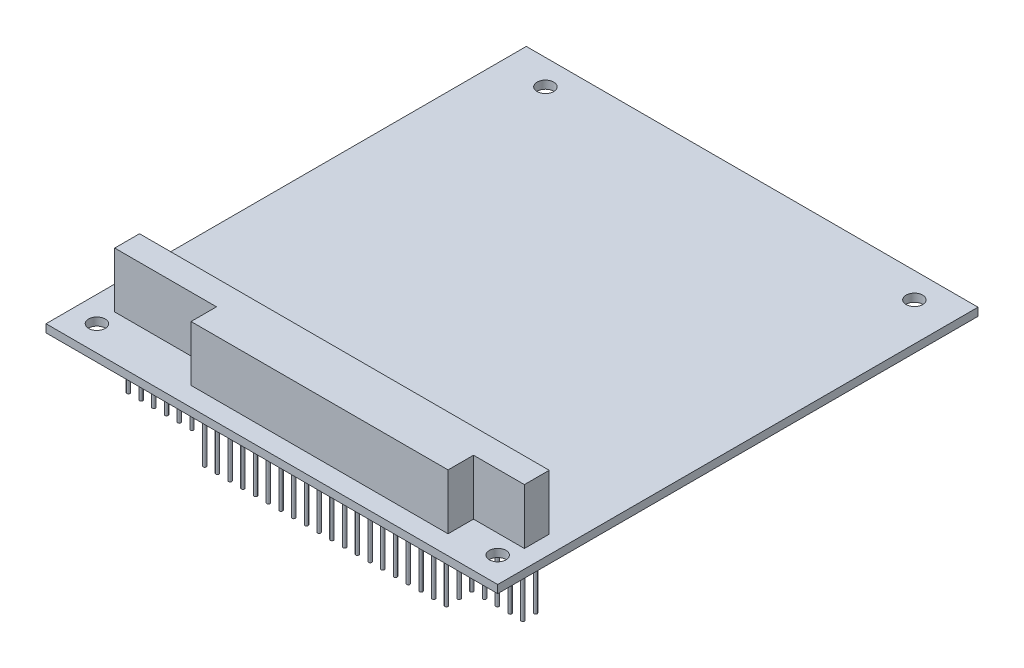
SolidWorks part; units mm, degrees
ref_plane "Front" through (0, 0, 0) normal (0, 0, 1) x (1, 0, 0)
ref_plane "Top" through (0, 0, 0) normal (0, 1, 0) x (1, 0, 0)
ref_plane "Right" through (0, 0, 0) normal (1, 0, 0) x (0, 0, -1)
sketch "Sketch1" plane through (0, 0, 0) normal (0, 1, 0) x (1, 0, 0)
  line L0 (45.085, -47.9425) -> (-45.085, 47.9425) construction
  line L1 (-45.085, 47.9425) -> (45.085, 47.9425)
  line L2 (-45.085, 47.9425) -> (-45.085, -47.9425)
  line L3 (-45.085, -47.9425) -> (45.085, -47.9425)
  line L4 (45.085, 47.9425) -> (45.085, -47.9425)
  circle A0 centre (-40.005, -42.8625) radius 1.651
  circle A1 centre (40.005, -42.8625) radius 1.651
  circle A2 centre (-36.195, 42.8625) radius 1.651
  circle A3 centre (37.465, 42.8625) radius 1.651
  dimension "D3" = 80.01
  dimension "D5" = 73.66
  dimension "D7" = 85.725
  dimension "D9" = 3.302
  dimension "D16" = 7.62
  dimension "D6" = 8.89
  dimension "D4" = 5.08
  dimension "D1" = 90.17
  dimension "D2" = 95.885
  dimension "D8" = 5.08
  dimension "D11" = 85.09
  dimension "D13" = 90.805
  dimension "D15" = 82.55
extrude "Extrude1" add sketch "Sketch1" along normal blind 1.5875
sketch "Sketch3" plane through (0, 1.5875, 0) normal (0, 1, 0) x (-1, 0, 0)
  line L0 (19.939, 44.1325) -> (19.939, 39.0525)
  line L1 (19.939, 39.0525) -> (40.259, 39.0525)
  line L2 (40.259, 39.0525) -> (40.259, 34.0995)
  line L3 (40.259, 34.0995) -> (-41.529, 34.0995)
  line L4 (-41.529, 34.0995) -> (-41.529, 39.0525)
  line L5 (-41.529, 39.0525) -> (-31.369, 39.0525)
  line L6 (-31.369, 39.0525) -> (-31.369, 44.1325)
  line L7 (-31.369, 44.1325) -> (19.939, 44.1325)
  line L8 (45.085, 47.9425) -> (-45.085, 47.9425) construction
  line L9 (45.085, -47.9425) -> (45.085, 47.9425) construction
  dimension "D1" = 81.788
  dimension "D2" = 4.953
  dimension "D3" = 5.08
  dimension "D4" = 20.32
  dimension "D5" = 71.628
  dimension "D6" = 3.81
  dimension "D7" = 4.826
extrude "Extrude2" add sketch "Sketch3" along normal blind 11.049
sketch "Sketch4" plane through (0, 0, 0) normal (0, -1, 0) x (1, 0, 0)
  line L0 (-40.259, 34.0995) -> (41.529, 34.0995) construction
  line L1 (41.529, 34.0995) -> (41.529, 39.0525) construction
  circle A0 centre (40.005, 35.306) radius 0.3175
  dimension "D1" = 1.2065
  dimension "D2" = 0.635
  dimension "D3" = 1.524
extrude "Extrude3" add sketch "Sketch4" along normal blind 12.192
pattern_linear "LPattern1" count 32 spacing 2.54 along (-1, 0, 0) count 4 spacing 2.54 along (0, 0, 1) of "Extrude3"
sketch "Connector Area" plane through (0, 0, 0) normal (0, 1, 0) x (1, 0, 0)
  line L0 (-45.085, 47.9425) -> (-45.085, -47.9425) construction
  line L1 (-45.085, -39.6875) -> (-57.785, -39.6875)
  line L2 (-45.085, -39.6875) -> (-45.085, 39.6875)
  line L3 (-45.085, 39.6875) -> (-57.785, 39.6875)
  line L4 (-57.785, -39.6875) -> (-57.785, 39.6875)
  line L5 (-36.83, -47.9425) -> (-20.955, -47.9425)
  line L6 (-36.83, -47.9425) -> (-36.83, -60.6425)
  line L7 (-36.83, -60.6425) -> (-20.955, -60.6425)
  line L8 (-20.955, -47.9425) -> (-20.955, -60.6425)
  line L9 (45.085, -39.6875) -> (57.785, -39.6875)
  line L10 (45.085, -39.6875) -> (45.085, 39.6875)
  line L11 (45.085, 39.6875) -> (57.785, 39.6875)
  line L12 (57.785, -39.6875) -> (57.785, 39.6875)
  line L13 (-45.085, -47.9425) -> (45.085, -47.9425) construction
  line L14 (45.085, -47.9425) -> (45.085, 47.9425) construction
  dimension "D1" = 8.255
  dimension "D2" = 12.7
  dimension "D3" = 87.63
  dimension "D4" = 12.7
  dimension "D5" = 8.255
  dimension "D6" = 24.13
  dimension "D7" = 12.7
